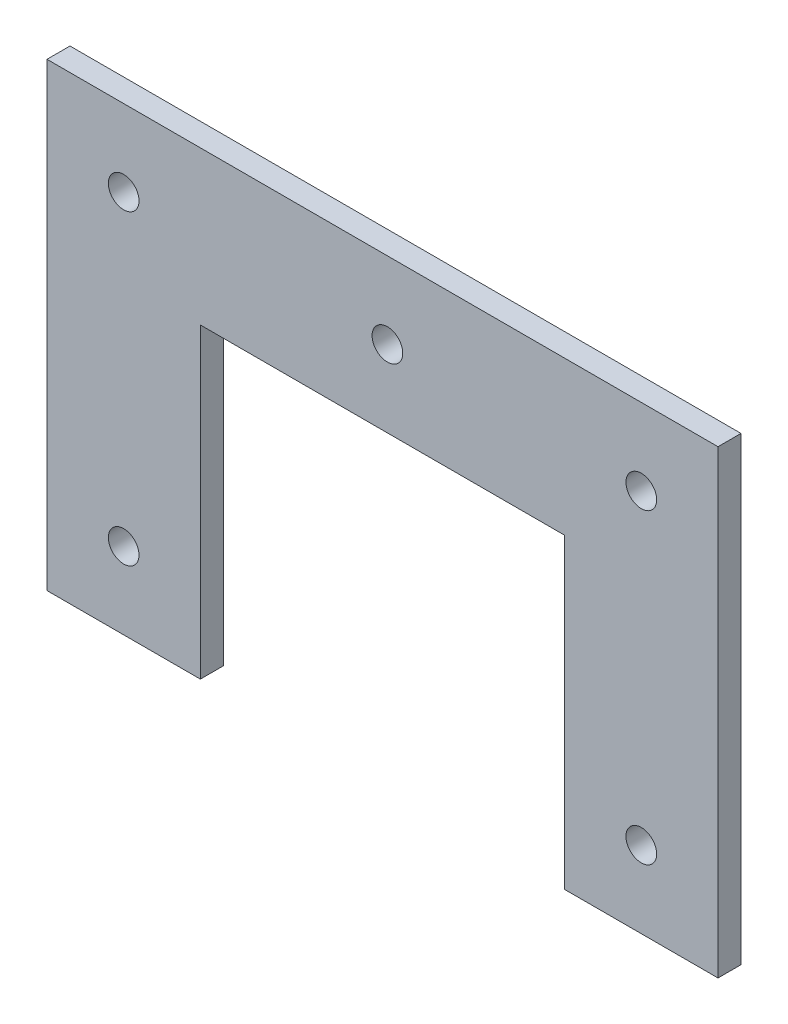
SolidWorks part; units mm, degrees
ref_plane "前视基准面" through (0, 0, 0) normal (0, 0, 1) x (1, 0, 0)
ref_plane "上视基准面" through (0, 0, 0) normal (0, 1, 0) x (1, 0, 0)
ref_plane "右视基准面" through (0, 0, 0) normal (1, 0, 0) x (0, 0, -1)
sketch "草图4" plane through (0, 0, 0) normal (0, 0, 1) x (1, 0, 0)
  line L1 (-43.75, 30) -> (43.75, 30)
  line L2 (-43.75, 30) -> (-43.75, -30)
  line L3 (-43.75, -30) -> (43.75, -30)
  line L4 (43.75, 30) -> (43.75, -30)
  line L5 (-43.75, 30) -> (43.75, -30) construction
  line L6 (-43.75, -30) -> (43.75, 30) construction
  point P0 (0, 0)
  dimension "D1" = 87.5
  dimension "D2" = 60
extrude "凸台-拉伸2" add sketch "草图4" along normal blind 3
sketch "草图5" plane through (0, 0, 3) normal (0, 0, 1) x (1, 0, 0)
  line L0 (-43.75, -30) -> (43.75, -30) construction
  line L1 (-23.75, -30) -> (23.75, -30)
  line L2 (-23.75, -30) -> (-23.75, 10)
  line L3 (-23.75, 10) -> (23.75, 10)
  line L4 (23.75, -30) -> (23.75, 10)
  line L5 (-43.75, 30) -> (-43.75, -30) construction
  line L6 (43.75, -30) -> (43.75, 30) construction
  line L7 (43.75, 30) -> (-43.75, 30) construction
  dimension "D1" = 20
  dimension "D2" = 20
  dimension "D3" = 20
extrude "切除-拉伸1" cut sketch "草图5" against normal blind 3
hole_wizard "Ø4.0 (4) 直径孔2" positions "草图6" profile "草图7" hole size "Ø4.0" standard "GB"
sketch "草图6" plane through (0, 0, 3) normal (0, 0, 1) x (1, 0, 0)
  line L0 (43.75, 30) -> (-43.75, 30) construction
  line L1 (-43.75, 30) -> (-43.75, -30) construction
  line L2 (43.75, -30) -> (43.75, 30) construction
  line L3 (23.75, -30) -> (43.75, -30) construction
  line L4 (-43.75, -30) -> (-23.75, -30) construction
  point P0 (-33.75, -20)
  point P2 (-33.75, 20)
  point P4 (0.6409, 20)
  point P6 (33.75, 20)
  point P8 (33.75, -20)
  point P11 (0, 0)
  dimension "D1" = 10
  dimension "D2" = 10
  dimension "D3" = 10
  dimension "D4" = 10
  dimension "D5" = 10
sketch "草图7" plane through (-33.75, -20, 3) normal (1, 0, 0) x (0, -1, 0)
  line L0 (0, 0) -> (0, 3)
  line L1 (0, 3) -> (2, 3)
  line L2 (2, 3) -> (2, 0)
  line L5 (2, 0) -> (0, 0)
  line L11 (0, -6.35) -> (0, 107.95) construction
  dimension "通孔孔直径" = 4
  dimension "通孔孔深度" = 3
